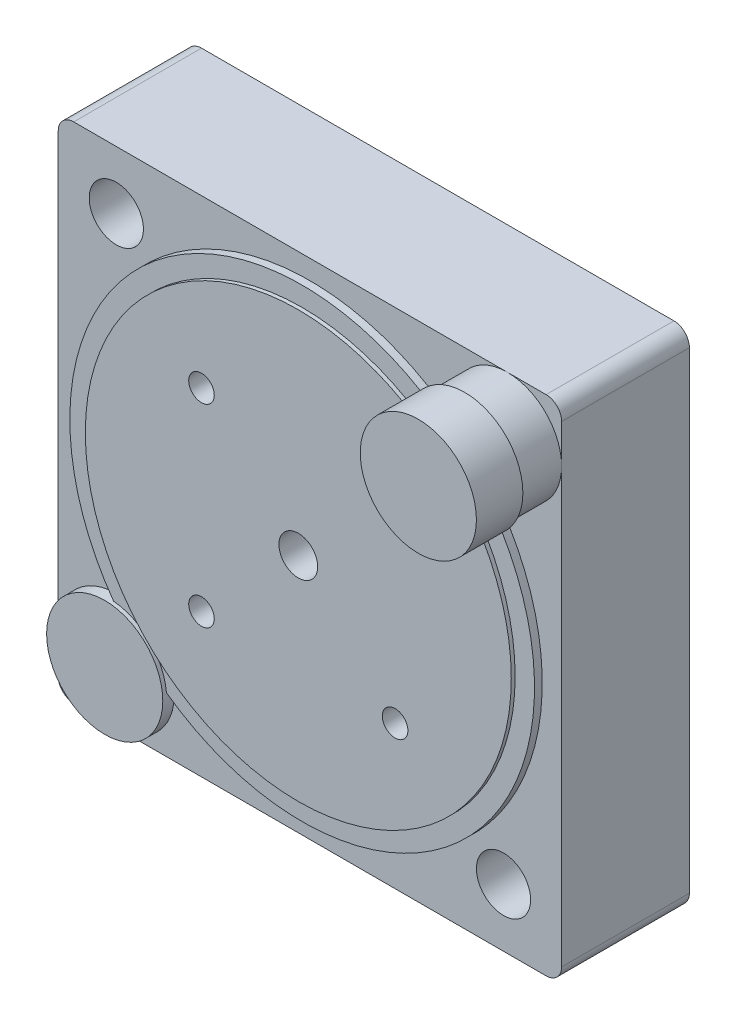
SolidWorks part; units mm, degrees
ref_plane "前视基准面" through (0, 0, 0) normal (0, 0, 1) x (1, 0, 0)
ref_plane "上视基准面" through (0, 0, 0) normal (0, 1, 0) x (1, 0, 0)
ref_plane "右视基准面" through (0, 0, 0) normal (1, 0, 0) x (0, 0, -1)
sketch "草图1" plane through (0, 0, 0) normal (0, 0, 1) x (1, 0, 0)
  line L1 (-32.5, 32.5) -> (32.5, 32.5)
  line L2 (-32.5, 32.5) -> (-32.5, -32.5)
  line L3 (-32.5, -32.5) -> (32.5, -32.5)
  line L4 (32.5, 32.5) -> (32.5, -32.5)
  line L5 (-32.5, 32.5) -> (32.5, -32.5) construction
  line L6 (-32.5, -32.5) -> (32.5, 32.5) construction
  point P0 (0, 0)
  dimension "D1" = 65
  dimension "D2" = 65
extrude "凸台-拉伸1" add sketch "草图1" along normal blind 16.5
sketch "草图2" plane through (0, 0, 16.5) normal (0, 0, 1) x (1, 0, 0)
  circle A0 centre (0, 0) radius 30
  dimension "D1" = 60
extrude "凸台-拉伸2" add sketch "草图2" along normal blind 1.5
sketch "草图4" plane through (0, 0, 18) normal (0, 0, 1) x (1, 0, 0)
  circle A0 centre (0, 0) radius 27.5
  dimension "D1" = 55
extrude "切除-拉伸1" cut sketch "草图4" against normal blind 0.5 flip side to cut
sketch "草图3" plane through (0, 0, 16.5) normal (0, 0, 1) x (1, 0, 0)
  line L0 (-32.5, -32.5) -> (32.5, -32.5) construction
  line L1 (-32.5, 32.5) -> (-32.5, -32.5) construction
  circle A0 centre (-25, -25) radius 7.5
  dimension "D3" = 15
  dimension "D1" = 7.5
  dimension "D2" = 7.5
extrude "凸台-拉伸3" add sketch "草图3" along normal blind 1.5
sketch "草图5" plane through (0, 0, 16.5) normal (0, 0, 1) x (1, 0, 0)
  line L0 (32.5, -32.5) -> (32.5, 32.5) construction
  line L1 (32.5, 32.5) -> (-32.5, 32.5) construction
  circle A0 centre (25.5, 25.5) radius 7
  dimension "D3" = 14
  dimension "D1" = 7
  dimension "D2" = 7
extrude "凸台-拉伸4" add sketch "草图5" along normal blind 11.5
sketch "草图6" plane through (0, 0, 28) normal (0, 0, 1) x (1, 0, 0)
  circle A0 centre (25.5, 25.5) radius 7.5
  dimension "D1" = 15
extrude "凸台-拉伸5" add sketch "草图6" against normal blind 6
hole_wizard "Ø7.0 (7) 直径孔1" positions "草图7" profile "草图8" hole size "Ø7.0" standard "GB"
sketch "草图7" plane through (0, 0, 16.5) normal (0, 0, 1) x (1, 0, 0)
  point P0 (-25, 25)
  point P2 (25, -25)
  dimension "D1" = 25
  dimension "D2" = 25
  dimension "D3" = 25
  dimension "D4" = 25
sketch "草图8" plane through (-25, 25, 16.5) normal (1, 0, 0) x (0, -1, 0)
  line L0 (0, 0) -> (0, 16.5)
  line L1 (0, 16.5) -> (3.5, 16.5)
  line L2 (3.5, 16.5) -> (3.5, 0)
  line L5 (3.5, 0) -> (0, 0)
  line L11 (0, -6.35) -> (0, 107.95) construction
  dimension "通孔孔直径" = 7
  dimension "通孔孔深度" = 16.5
hole_wizard "M6 螺纹孔1" positions "草图9" profile "草图10" tap size "M6" standard "GB"
sketch "草图9" plane through (0, 0, 18) normal (0, 0, 1) x (1, 0, 0)
  point P0 (0, 0)
sketch "草图10" plane through (0, 0, 18) normal (1, 0, 0) x (0, -1, 0)
  line L0 (0, 0) -> (0, 18)
  line L1 (0, 18) -> (2.5, 18)
  line L2 (2.5, 18) -> (2.5, 0)
  line L5 (2.5, 0) -> (0, 0)
  line L11 (0, -6.35) -> (0, 107.95) construction
  dimension "通孔螺纹孔钻头直径" = 5
  dimension "通孔螺纹孔钻头深度" = 18
hole_wizard "M4 螺纹孔1" positions "草图11" profile "草图12" tap size "M4" standard "GB"
sketch "草图11" plane through (0, 0, 18) normal (0, 0, 1) x (1, 0, 0)
  point P0 (-12.5, 12.5)
  point P2 (12.5, 12.5)
  point P4 (-12.5, -12.5)
  point P6 (12.5, -12.5)
  point P9 (0, 0)
  point P10 (0, 0)
  point P11 (0, 0)
  point P12 (0, 0)
  dimension "D1" = 25
  dimension "D2" = 25
  dimension "D3" = 12.5
  dimension "D4" = 12.5
sketch "草图12" plane through (-12.5, 12.5, 18) normal (1, 0, 0) x (0, -1, 0)
  line L0 (0, 0) -> (0, 18)
  line L1 (0, 18) -> (1.65, 18)
  line L2 (1.65, 18) -> (1.65, 0)
  line L5 (1.65, 0) -> (0, 0)
  line L11 (0, -6.35) -> (0, 107.95) construction
  dimension "通孔螺纹孔钻头直径" = 3.3
  dimension "通孔螺纹孔钻头深度" = 18
fillet "圆角1" radius 2 4 edges at (-32.5, 32.5, 8.25) (32.5, 32.5, 8.25) (32.5, -32.5, 8.25) (-32.5, -32.5, 8.25)
hole_wizard "M6 螺纹孔2" positions "草图13" profile "草图14" tap size "M6" standard "GB"
sketch "草图13" plane through (-32.5, 0, 0) normal (-1, 0, 0) x (0, 0, 1)
  point P0 (9, 0)
  dimension "D1" = 9
sketch "草图14" plane through (-32.5, 0, 9) normal (0, 1, 0) x (0, 0, 1)
  line L0 (0, 0) -> (0, 16.5022)
  line L1 (0, 16.5022) -> (2.5, 15)
  line L2 (2.5, 15) -> (2.5, 0)
  line L5 (2.5, 0) -> (0, 0)
  line L10 (0, 16.5022) -> (-2.5, 15) construction
  line L11 (0, -6.35) -> (0, 107.95) construction
  dimension "螺纹孔钻头直径" = 5
  dimension "螺纹孔钻头深度" = 15
  dimension "导头角度" = 118
sketch "草图15" plane through (0, -32.5, 0) normal (0, -1, 0) x (1, 0, 0)
  line L0 (-14.3159, 1.3988) -> (14.6127, 1.3988) construction
  text T0 "派迪威"
extrude "切除-拉伸2" cut sketch "草图15" against normal blind 3
